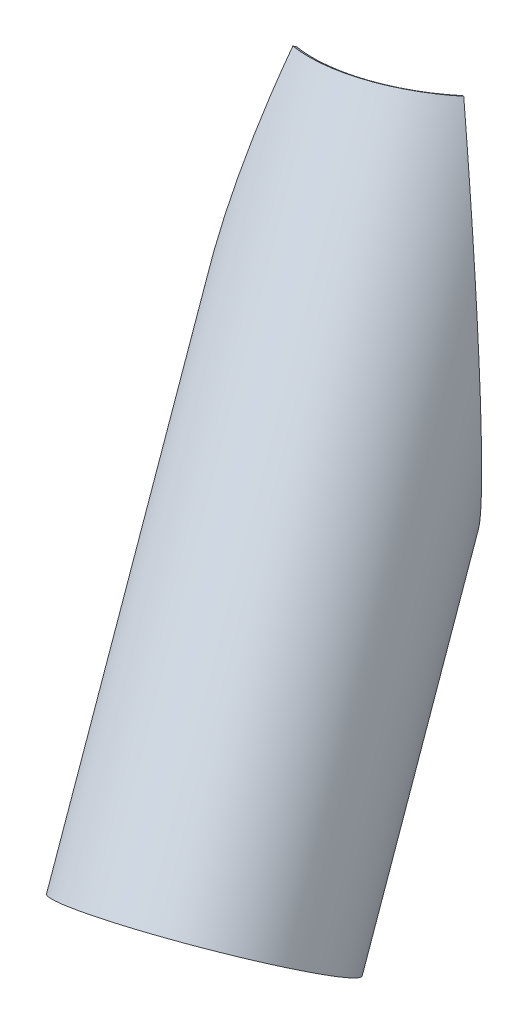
SolidWorks part; units mm, degrees
ref_plane "前视基准面" through (0, 0, 0) normal (0, 0, 1) x (1, 0, 0)
ref_plane "上视基准面" through (0, 0, 0) normal (0, 1, 0) x (1, 0, 0)
ref_plane "右视基准面" through (0, 0, 0) normal (1, 0, 0) x (0, 0, -1)
imported_body "基体零件-等径Y形五通管-1"
sheet metal parameters "钣金1" parameters "D1"=0.7366, "厚度"=6
bend "圆角折弯1" bend radius 204 bend angle 359.727 parameters "D5"=1
flatten bends "展开-折弯1"
sketch "尖角-草图1" plane through (75.0812, -748.5111, 232.6943) normal (-0.2598, -0.5528, -0.7918) x (-0.9657, 0.1487, 0.213)
  line L0 (708.3234, 320.8498) -> (552.2779, -547.4082) construction
  dimension "D1" = 0
process bends "加工-折弯1" parameters "D1"=0
sketch "平面-草图1" plane through (75.0812, -748.5111, 232.6943) normal (-0.2598, -0.5528, -0.7918) x (-0.9657, 0.1487, 0.213)
